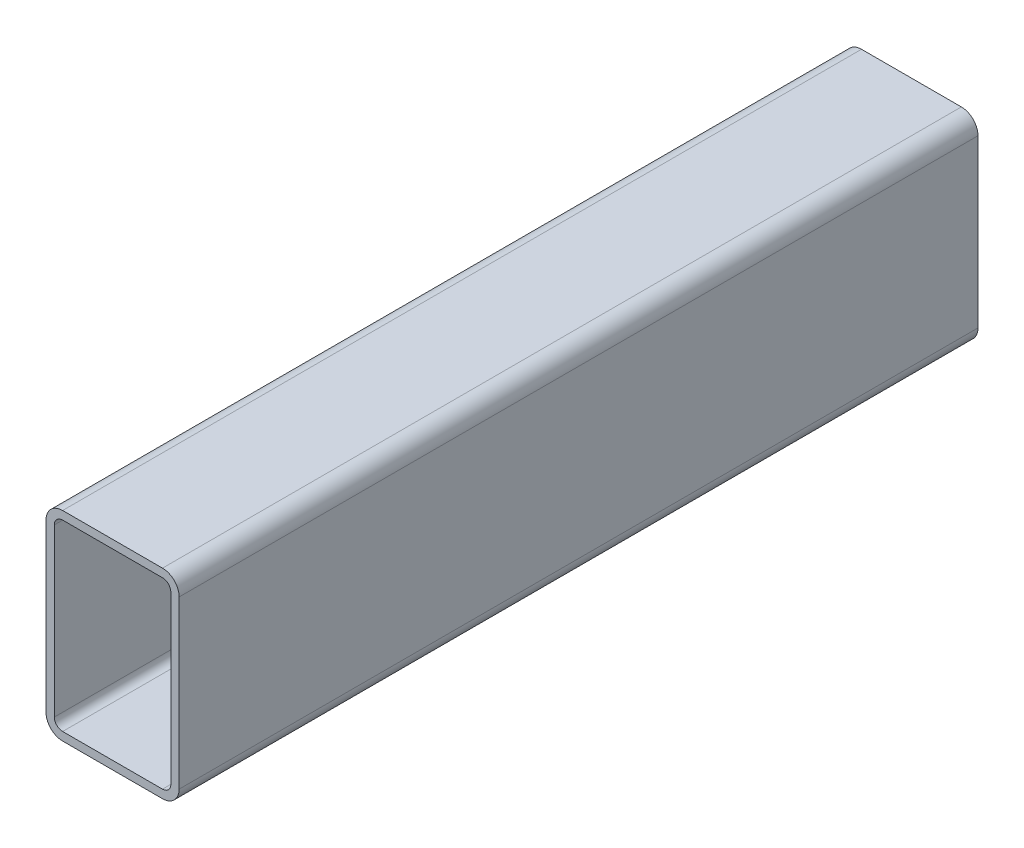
SolidWorks part; units mm, degrees
ref_plane "Front Plane" through (0, 0, 0) normal (0, 0, 1) x (1, 0, 0)
ref_plane "Top Plane" through (0, 0, 0) normal (0, 1, 0) x (1, 0, 0)
ref_plane "Right Plane" through (0, 0, 0) normal (1, 0, 0) x (0, 0, -1)
sketch "Sketch1" plane through (0, 0, 0) normal (0, 0, 1) x (1, 0, 0)
  line B0 (6.35, 76.2) -> (44.45, 76.2)
  arc B1 (50.8, 69.85) -> (44.45, 76.2) centre (44.45, 69.85) ccw
  line B2 (50.8, 69.85) -> (50.8, 6.35)
  arc B3 (44.45, 0) -> (50.8, 6.35) centre (44.45, 6.35) ccw
  line B4 (44.45, 0) -> (6.35, 0)
  arc B5 (0, 6.35) -> (6.35, 0) centre (6.35, 6.35) ccw
  line B6 (0, 6.35) -> (0, 69.85)
  arc B7 (6.35, 76.2) -> (0, 69.85) centre (6.35, 69.85) ccw
  line B8 (6.35, 73.025) -> (44.45, 73.025)
  arc B9 (47.625, 69.85) -> (44.45, 73.025) centre (44.45, 69.85) ccw
  line B10 (47.625, 69.85) -> (47.625, 6.35)
  arc B11 (44.45, 3.175) -> (47.625, 6.35) centre (44.45, 6.35) ccw
  line B12 (44.45, 3.175) -> (6.35, 3.175)
  arc B13 (3.175, 6.35) -> (6.35, 3.175) centre (6.35, 6.35) ccw
  line B14 (3.175, 6.35) -> (3.175, 69.85)
  arc B15 (6.35, 73.025) -> (3.175, 69.85) centre (6.35, 69.85) ccw
sketch_block_instance "HSS3x2x0.125-1"
sketch_block "HSS3x2x0.125"
extrude "Boss-Extrude1" add sketch "Sketch1" along normal blind 304.8
